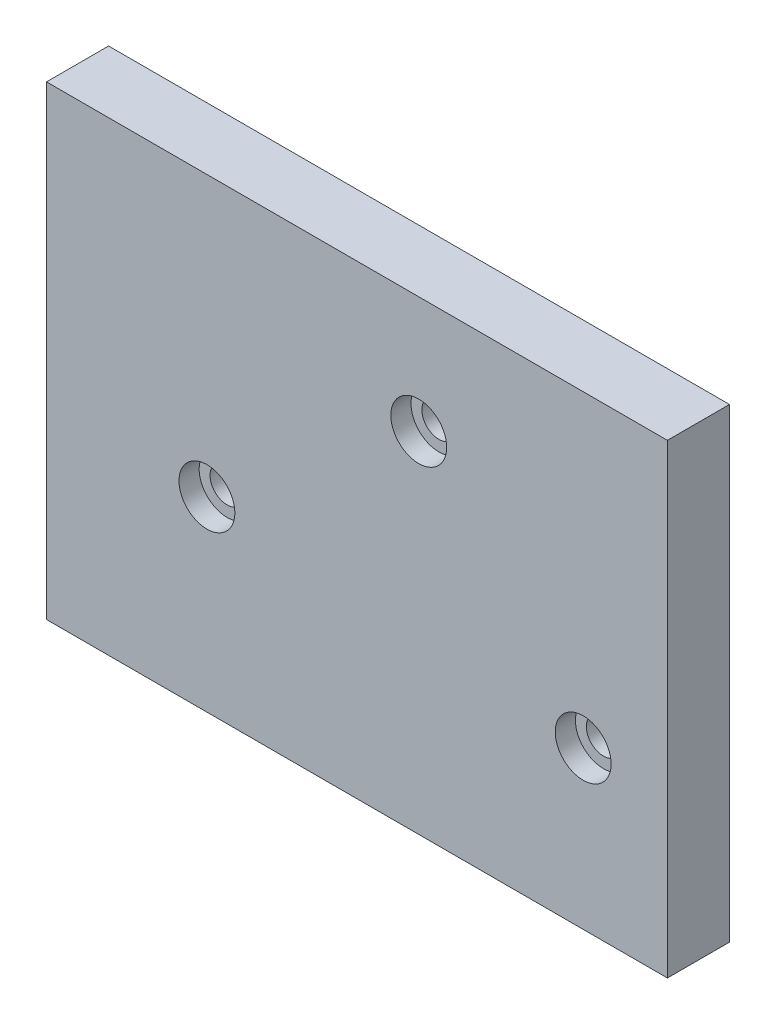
SolidWorks part; units mm, degrees
ref_plane "Ebene vorne" through (0, 0, 0) normal (0, 0, 1) x (1, 0, 0)
ref_plane "Ebene oben" through (0, 0, 0) normal (0, 1, 0) x (1, 0, 0)
ref_plane "Ebene rechts" through (0, 0, 0) normal (1, 0, 0) x (0, 0, -1)
sketch "Skizze1" plane through (0, 0, 0) normal (0, 0, 1) x (1, 0, 0)
  line L0 (100, 75) -> (-100, -75) construction
  line L1 (-100, 75) -> (100, 75)
  line L2 (-100, 75) -> (-100, -75)
  line L3 (-100, -75) -> (100, -75)
  line L4 (100, 75) -> (100, -75)
  dimension "D1" = 150
  dimension "D2" = 200
extrude "Linear austragen1" add sketch "Skizze1" along normal blind 20
hole_wizard "Stirnsenkung für M10 Zylinderschraube mit Innensechskant2" positions "Skizze4" profile "Skizze5" counterbore size "M10" standard "DIN"
sketch "Skizze4" plane through (0, 0, 20) normal (0, 0, 1) x (1, 0, 0)
  point P0 (-48.3308, -14.941)
  point P2 (19.903, 37.4631)
  point P4 (72.8706, -24.4007)
sketch "Skizze5" plane through (-48.3308, -14.941, 20) normal (1, 0, 0) x (0, -1, 0)
  line L0 (0, 0) -> (0, 20)
  line L1 (0, 20) -> (5.5, 20)
  line L2 (5.5, 20) -> (5.5, 6.5)
  line L3 (5.5, 6.5) -> (9, 6.5)
  line L4 (9, 6.5) -> (9, 0)
  line L5 (9, 0) -> (0, 0)
  line L6 (0, -6.35) -> (0, 107.95) construction
  dimension "Bohrerdurchmesser" = 11
  dimension "Bohrungstiefe" = 20
  dimension "Senkdurchmesser2" = 18
  dimension "Senktiefe2" = 6.5
